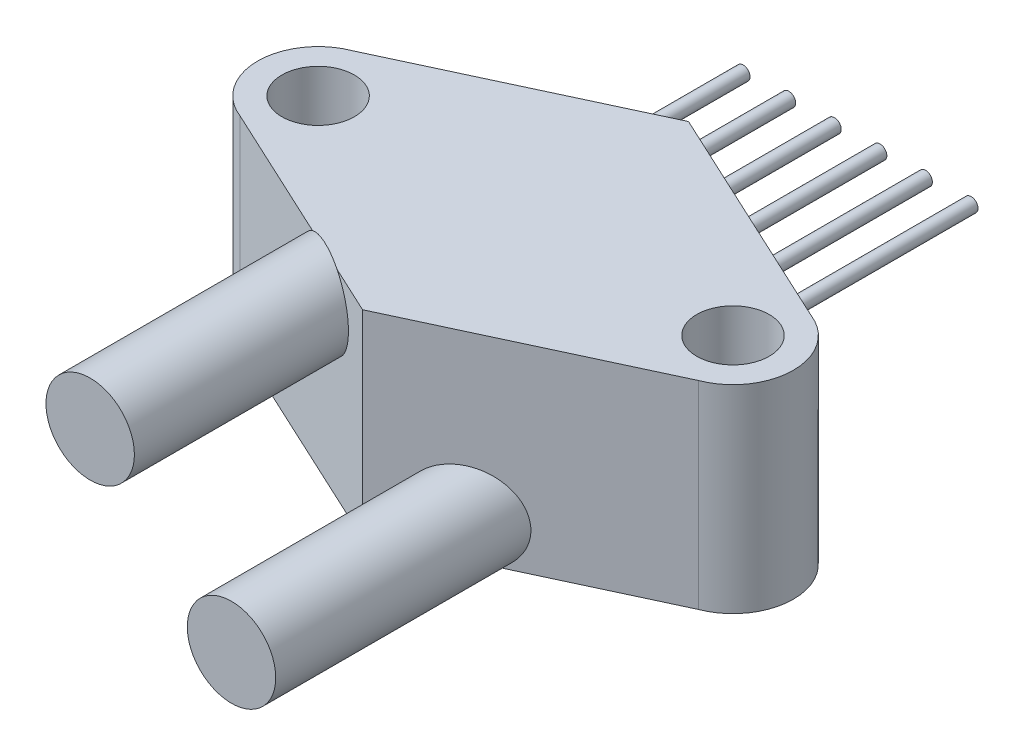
SolidWorks part; units mm, degrees
ref_plane "Front Plane" through (0, 0, 0) normal (0, 0, 1) x (1, 0, 0)
ref_plane "Top Plane" through (0, 0, 0) normal (0, 1, 0) x (1, 0, 0)
ref_plane "Right Plane" through (0, 0, 0) normal (1, 0, 0) x (0, 0, -1)
sketch "Sketch1" plane through (0, 0, 0) normal (0, 1, 0) x (1, 0, 0)
  line L0 (0, 9.0805) -> (0, -9.0805) construction
  line L1 (0, -9.0805) -> (-12.7655, -3.141)
  line L2 (0, 9.0805) -> (-12.7655, 3.141)
  line L4 (0, 9.0805) -> (12.7655, 3.141)
  line L5 (0, -9.0805) -> (12.7655, -3.141)
  circle A0 centre (11.557, 0) radius 2.0193
  arc A1 (12.7655, -3.141) -> (12.7655, 3.141) centre (11.557, 0) ccw
  arc A2 (-12.7655, -3.141) -> (-12.7655, 3.141) centre (-11.557, 0) cw
  circle A3 centre (-11.557, 0) radius 2.0193
extrude "Extrude1" add sketch "Sketch1" along normal blind 11.049
ref_plane "Plane1" through (0, 0, 9.144) normal (0, 0, 1) x (1, 0, 0)
sketch "Sketch2" plane through (0, 0, 9.144) normal (0, 0, 1) x (1, 0, 0)
  circle A0 centre (3.937, 2.1082) radius 2.4638
extrude "Extrude2" add sketch "Sketch2" along normal blind 11.176 and the other way up to surface
sketch "Sketch3" plane through (0, 0, 9.144) normal (0, 0, 1) x (1, 0, 0)
  circle A0 centre (-3.937, 8.9408) radius 2.4638
extrude "Extrude3" add sketch "Sketch3" along normal blind 11.176 and the other way up to surface
ref_plane "Plane2" through (0, 0, -9.144) normal (0, 0, 1) x (1, 0, 0)
sketch "Sketch4" plane through (0, 0, -9.144) normal (0, 0, 1) x (1, 0, 0)
  line L0 (0, 5.5245) -> (0, 7.0563) construction
  line L2 (0, 11.049) -> (0, 0) construction
  circle A0 centre (-1.27, 5.5245) radius 0.381
  circle A1 centre (-3.81, 5.5245) radius 0.381
  circle A2 centre (-6.35, 5.5245) radius 0.381
  circle A3 centre (6.35, 5.5245) radius 0.381
  circle A4 centre (3.81, 5.5245) radius 0.381
  circle A5 centre (1.27, 5.5245) radius 0.381
extrude "Extrude4" add sketch "Sketch4" along normal blind 11.176 and the other way blind 9.3345
